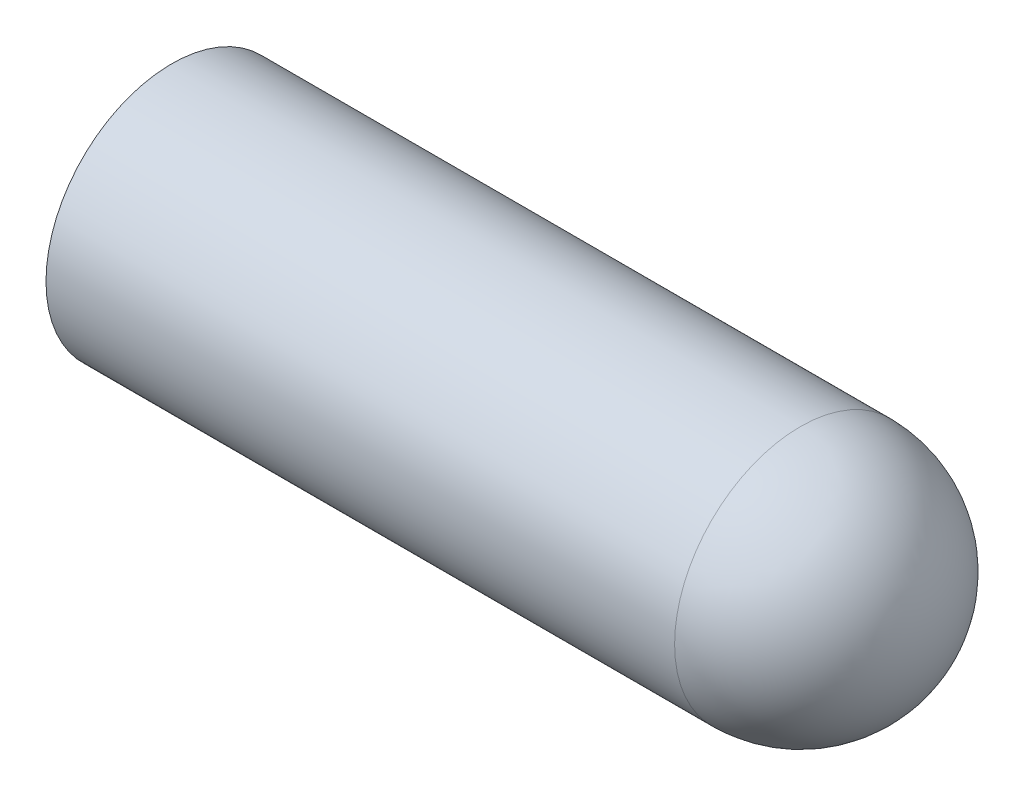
SolidWorks part; units mm, degrees
ref_plane "Front" through (0, 0, 0) normal (0, 0, 1) x (1, 0, 0)
ref_plane "Top" through (0, 0, 0) normal (0, 1, 0) x (1, 0, 0)
ref_plane "Right" through (0, 0, 0) normal (1, 0, 0) x (0, 0, -1)
sketch "Esquisse1" plane through (0, 0, 0) normal (0, 0, 1) x (1, 0, 0)
  line L0 (50, 0) -> (-50, 0) construction
  line L1 (0, 10) -> (-50, 10)
  line L2 (-50, 10) -> (-50, 8.8)
  line L3 (-50, 8.8) -> (0, 8.8)
  line L4 (0, -50) -> (0, 50) construction
  line L5 (8.8, 0) -> (10, 0)
  line L6 (-56.5203, 0) -> (28.6457, 0) construction
  arc A0 (10, 0) -> (0, 10) centre (0, 0) ccw
  arc A1 (0, 8.8) -> (8.8, 0) centre (0, 0) cw
  dimension "D1" = 60
  dimension "D2" = 8.8
  dimension "D3" = 10
revolve "Révolution1" add sketch "Esquisse1" angle 360 about L6
